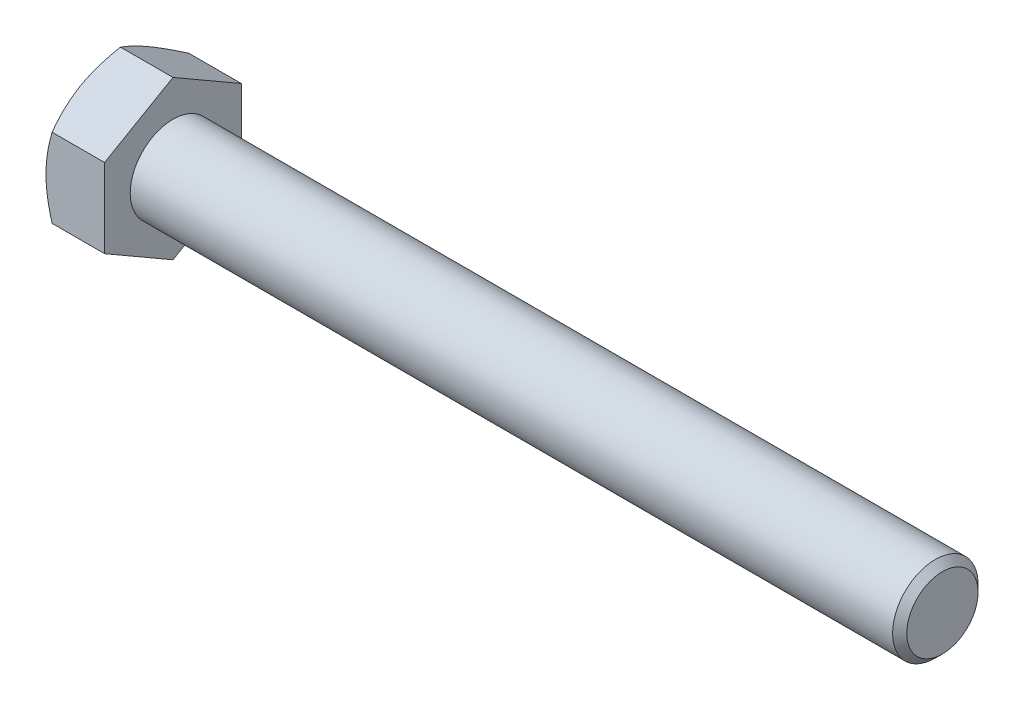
SolidWorks part; units mm, degrees
ref_plane "Plane1" through (0, 0, 0) normal (0, 0, 1) x (1, 0, 0)
ref_plane "Plane2" through (0, 0, 0) normal (0, 1, 0) x (1, 0, 0)
ref_plane "Plane3" through (0, 0, 0) normal (1, 0, 0) x (0, 0, -1)
sketch "Sketch1" plane through (0, 0, 0) normal (1, 0, 0) x (0, 0, -1)
  line L0 (8, 4.6188) -> (8, -4.6188)
  line L1 (-8, 4.6188) -> (-8, -4.6188)
  line L2 (8, -4.6188) -> (0, -9.2376)
  line L3 (0, -9.2376) -> (-8, -4.6188)
  line L4 (8, 4.6188) -> (0, 9.2376)
  line L5 (0, 9.2376) -> (-8, 4.6188)
  dimension "Width_flats" = 16
  dimension "D2" = 120
  dimension "D3" = 8
  dimension "D4" = 8
  dimension "D5" = 8
extrude "BaseHead" add sketch "Sketch1" along normal blind 6.85
sketch "BodySke" plane through (0, 0, 0) normal (0, 0, 1) x (1, 0, 0)
  line L0 (0, 4.6188) -> (0, -4.6188) construction
  line L1 (0, 0) -> (96.85, 0)
  line L2 (0, 0) -> (0, 5)
  line L3 (0, 5) -> (96.022, 5)
  line L4 (96.85, 0) -> (96.85, 4.172)
  line L5 (6.85, 9.2376) -> (6.85, 4.6188) construction
  line L6 (96.85, 4.172) -> (96.022, 5)
  line L7 (0, 0) -> (96.52, 0) construction
  line L8 (96.85, -4.172) -> (96.022, -5) construction
  line L9 (0, -5) -> (96.022, -5) construction
  line L10 (8.35, 15.24) -> (8.35, -1.27) construction
  line L11 (70.85, 15.24) -> (70.85, -1.27) construction
  line L12 (6.85, 4.6188) -> (6.85, -4.6188) construction
  dimension "Length" = 90
  dimension "Body_ch_ang" = 45
  dimension "Diameter" = 10
  dimension "Minor_dia" = 8.344
  dimension "Advance" = 1.5
  dimension "Thread_nom" = 26
revolve "BaseBody" add sketch "BodySke"
fillet "HeadFillet" [suppressed] radius 0.4
sketch "Sketch3" plane through (0, 0, 0) normal (0, 0, 1) x (1, 0, 0)
  line L0 (0, 8) -> (3.6013, 14.2376)
  line L1 (0, 9.2376) -> (0, 4.6188) construction
  line L2 (3.6013, 14.2376) -> (3.6013, 19.2376)
  line L3 (3.6013, 19.2376) -> (-10, 19.2376)
  line L4 (-10, 19.2376) -> (-10, 8)
  line L5 (-10, 8) -> (0, 8)
  line L6 (0, 0) -> (99.06, 0) construction
  line L7 (6.85, 9.2376) -> (0, 9.2376) construction
  dimension "D1" = 8
  dimension "D2" = 5
  dimension "D3" = 10
  dimension "D4" = 5
  dimension "Head_ch_ang" = 30
revolve "HeadChamfer" cut sketch "Sketch3" angle 360 about L6
sketch "Sketch4" plane through (0, 0, 0) normal (0, 0, 1) x (1, 0, 0)
  line L1 (6.85, 9.2376) -> (6.85, 4.6188) construction
  line L2 (6.85, 8) -> (6.25, 8)
  line L3 (6.85, 8) -> (6.85, 19.2376)
  line L4 (6.85, 19.2376) -> (6.25, 19.2376)
  line L5 (0, 0) -> (95.25, 0) construction
  line L6 (0, 0) -> (96.52, 0) construction
  line L7 (6.25, 8) -> (6.25, 19.2376)
  line L8 (6.85, 9.2376) -> (0.7145, 9.2376) construction
  dimension "D1" = 16
  dimension "D2" = 10
  dimension "Bearing_ht" = 0.6
revolve "BearingFace" [suppressed] cut sketch "Sketch4" angle 360 about L5
sketch "ThdSchSke" plane through (0, 0, 0) normal (0, 0, 1) x (1, 0, 0)
  line L0 (70.85, -4.172) -> (70.2702, -5)
  line L1 (70.85, -4.172) -> (71.4298, -5)
  line L2 (71.4298, -5) -> (71.4298, -6.25)
  line L3 (-3.175, 0) -> (5.1513, 0) construction
  line L5 (71.4298, -6.25) -> (70.2702, -6.25)
  line L6 (70.2702, -6.25) -> (70.2702, -5)
  dimension "Thread_minor" = 8.344
  dimension "Diameter" = 10
  dimension "Start" = 70.85
  dimension "SideAngle" = 55
  dimension "VeeAngle" = 70
  dimension "Overcut" = 12.5
revolve "ThreadSchematic" [suppressed] cut sketch "ThdSchSke" angle 360 about L3
pattern_linear "ThdSchPat" [suppressed]
equation "\"D3@Sketch1\" = \"Width_flats@Sketch1\" / 2"
equation "\"D4@Sketch1\" = \"D3@Sketch1\""
equation "\"D5@Sketch1\" = \"D4@Sketch1\""
equation "\"Thread_minor@ThreadCosmetic\" = \"Minor_dia@BodySke\""
equation "\"D1@Sketch3\" = \"Width_flats@Sketch1\" / 2"
equation "\"D1@Sketch4\" = \"Width_flats@Sketch1\""
equation "\"Thread_length@ThreadCosmetic\" = ((sgn( (\"Length@BodySke\" - \"Advance@BodySke\" ) - \"Thread_nom@BodySke\" )-1)*( (\"Length@BodySke\" - \"Advance@BodySke\" ) - \"Thread_nom@BodySke\" ))/-2+ \"Thread_nom@BodySke\""
equation "\"Thread_minor@ThdSchSke\" = \"Minor_dia@BodySke\""
equation "\"Diameter@ThdSchSke\" = \"Diameter@BodySke\""
equation "\"Overcut@ThdSchSke\" = \"Diameter@BodySke\" * 1.25"
equation "\"Start@ThdSchSke\" = \"Head_ht@BaseHead\" + \"Length@BodySke\" - \"Thread_length@ThreadCosmetic\"  '---Non-countersunk---"
equation "\"Num_threads@ThdSchPat\" = int( \"Thread_length@ThreadCosmetic\" / \"Advance@BodySke\" + 0.999 )  + 1"
equation "\"Advance@ThdSchPat\" = \"Thread_length@ThreadCosmetic\" /  (\"Num_threads@ThdSchPat\" - 1) 'relax it"
equation "\"Num_threads@ThdSchPat\" = \"Num_threads@ThdSchPat\" - sgn( \"Num_threads@ThdSchPat\" - 1) '---chamfered tips only---"
